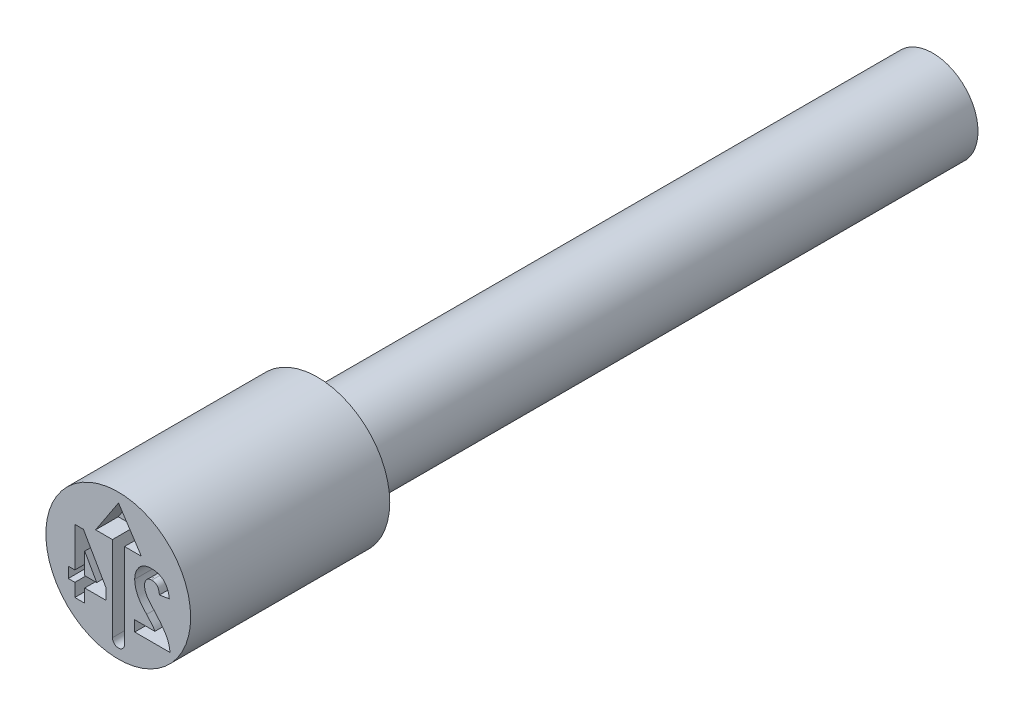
SolidWorks part; units mm, degrees
ref_plane "Front Plane" through (0, 0, 0) normal (0, 0, 1) x (1, 0, 0)
ref_plane "Top Plane" through (0, 0, 0) normal (0, 1, 0) x (1, 0, 0)
ref_plane "Right Plane" through (0, 0, 0) normal (1, 0, 0) x (0, 0, -1)
sketch "Sketch2" plane through (0, 0, 0) normal (1, 0, 0) x (0, 0, -1)
  line L0 (0.4039, 0) -> (50000.4039, 0) construction
  line L6 (0, 0.8) -> (0, 0)
  line L7 (2.2, 0.8) -> (0, 0.8)
  line L8 (2.2, 0.5) -> (2.2, 0.8)
  line L9 (9, 0.5) -> (2.2, 0.5)
  line L10 (9, 0) -> (9, 0.5)
  line L11 (0, 0) -> (9, 0)
  dimension "D1" = 1.6
  dimension "D2" = 1
  dimension "D3" = 9
  dimension "D4" = 2.2
revolve "Revolve1" add sketch "Sketch2" angle 360 about L0
sketch "Sketch3" plane through (0, 0, 0) normal (0, 0, 1) x (1, 0, 0)
  line L0 (0.0025, -0.0048) -> (0.0025, 34999.9952) construction
  line L1 (0.0692, 0.3124) -> (0.0692, -0.6265)
  line L2 (0.2552, 0.3124) -> (0.0692, 0.3124)
  line L3 (0.0025, 0.6959) -> (0.2552, 0.3124)
  line L4 (0.0025, 0.6959) -> (-0.2502, 0.3124)
  line L5 (-0.2502, 0.3124) -> (-0.0642, 0.3124)
  line L6 (-0.0642, 0.3124) -> (-0.0642, -0.6265)
  arc A0 (-0.0642, -0.6265) -> (0.0692, -0.6265) centre (0.0025, -0.6265) ccw
extrude "Cut-Extrude4" cut sketch "Sketch3" against normal blind 0.25
sketch "Sketch4" plane through (0, 0, 0) normal (0, 0, 1) x (1, 0, 0)
  text T0 "2  4" font "Arial Narrow" height 0.7
  dimension "D1" = 0.45
extrude "Cut-Extrude5" cut sketch "Sketch4" against normal blind 0.25
